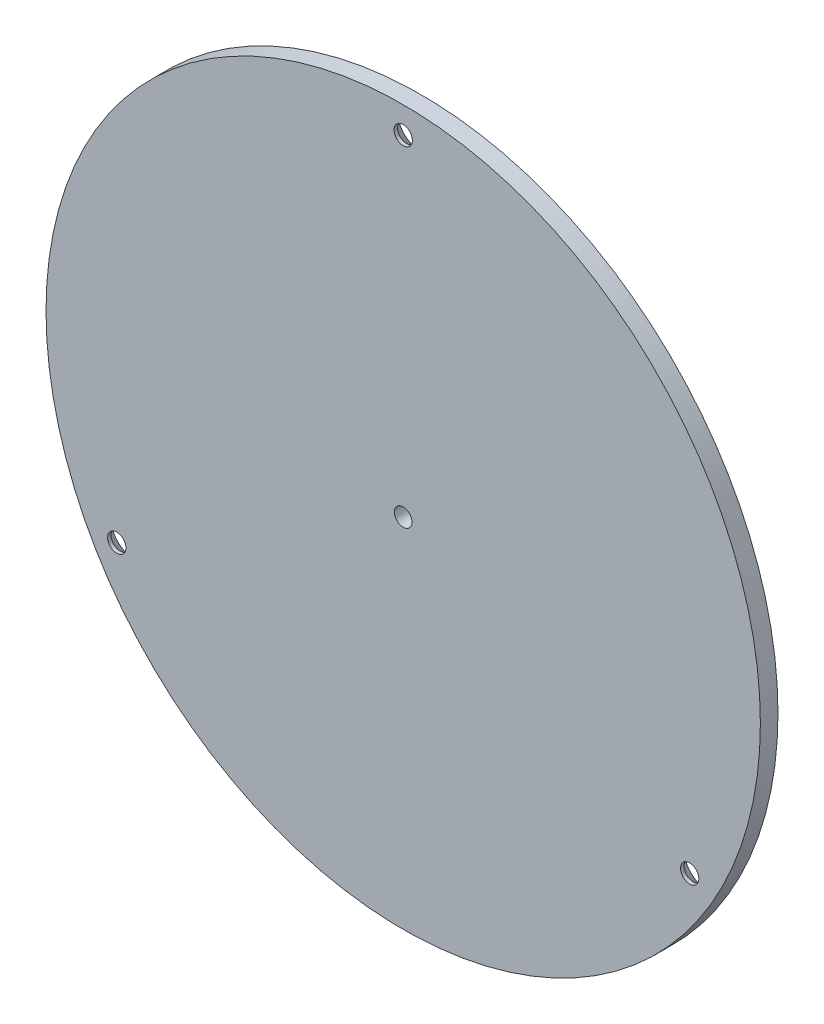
SolidWorks part; units mm, degrees
ref_plane "Płaszczyzna przednia" through (0, 0, 0) normal (0, 0, 1) x (1, 0, 0)
ref_plane "Płaszczyzna górna" through (0, 0, 0) normal (0, 1, 0) x (1, 0, 0)
ref_plane "Płaszczyzna prawa" through (0, 0, 0) normal (1, 0, 0) x (0, 0, -1)
sketch "Szkic1" plane through (0, 0, 0) normal (0, 0, 1) x (1, 0, 0)
  circle A0 centre (0, 0) radius 101.5
  dimension "D1" = 203
extrude "Dodanie-wyciągnięcie1" add sketch "Szkic1" along normal blind 5
sketch "Szkic2" plane through (0, 0, 5) normal (0, 0, 1) x (1, 0, 0)
  line L0 (0, 0) -> (0, 94) construction
  line L1 (0, 0) -> (-81.4064, -47) construction
  line L2 (0, 0) -> (81.4064, -47) construction
  circle A0 centre (0, 0) radius 2.5
  circle A1 centre (0, 94) radius 2.6
  circle A2 centre (81.4064, -47) radius 2.6
  circle A3 centre (-81.4064, -47) radius 2.6
  circle A4 centre (0, 94) radius 5 construction
  dimension "D1" = 5
  dimension "D4" = 5.2
  dimension "D6" = 10
  dimension "D2" = 120
  dimension "D3" = 120
  dimension "D5" = 94
extrude "Wytnij-wyciągnięcie1" cut sketch "Szkic2" against normal through all
chamfer "Sfazowanie1" distance 4 angle 45 3 edges at (2.6, 94, 0) (-78.8064, -47, 0) (84.0064, -47, 0)
